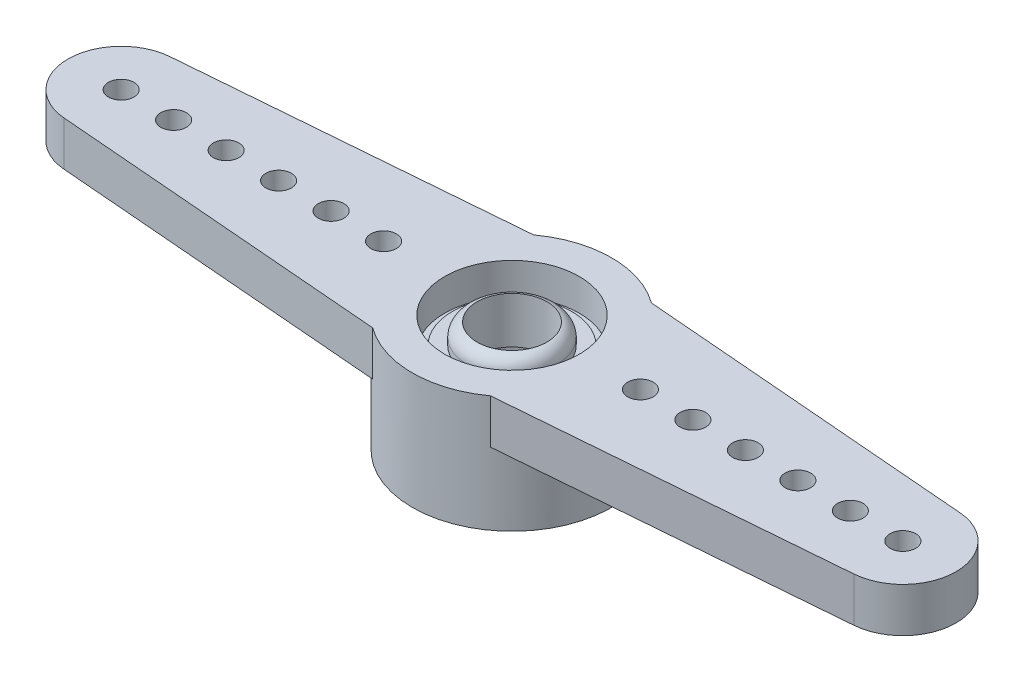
SolidWorks part; units mm, degrees
ref_plane "Front Plane" through (0, 0, 0) normal (0, 0, 1) x (1, 0, 0)
ref_plane "Top Plane" through (0, 0, 0) normal (0, 1, 0) x (1, 0, 0)
ref_plane "Right Plane" through (0, 0, 0) normal (1, 0, 0) x (0, 0, -1)
sketch "Sketch18" plane through (0, 0, 0) normal (0, 1, 0) x (1, 0, 0)
  line L0 (14.1859, 0) -> (-14.1859, 0) construction
  line L1 (-14.3431, 1.924) -> (-2.1374, 2.921)
  line L2 (-14.3431, -1.924) -> (-2.1374, -2.921)
  line L3 (14.3431, -1.924) -> (2.1374, -2.921)
  line L4 (14.3431, 1.924) -> (2.1374, 2.921)
  arc A0 (-2.1374, -2.921) -> (2.1374, -2.921) centre (0, 0) ccw
  arc A1 (-14.3431, 1.924) -> (-14.3431, -1.924) centre (-14.1859, 0) ccw
  arc A2 (14.3431, -1.924) -> (14.3431, 1.924) centre (14.1859, 0) ccw
  arc A3 (2.1374, 2.921) -> (-2.1374, 2.921) centre (0, 0) ccw
  point P3 (0, 0)
  dimension "D1" = 1.9304
  dimension "D2" = 3.6195
  dimension "D3" = 28.3718
  dimension "D5" = 5.842
  dimension "D8" = 1.9304
  dimension "D4" = 2.921
extrude "Extrude17" add sketch "Sketch18" along normal blind 1.6129
sketch "Sketch19" plane through (0, 1.6129, 0) normal (0, 1, 0) x (1, 0, 0)
  circle A0 centre (0, 0) radius 3.6195
  arc A1 (-2.1374, -2.921) -> (2.1374, -2.921) centre (0, 0) ccw construction
extrude "Extrude19" add sketch "Sketch19" against normal blind 4.2291
sketch "Sketch20" plane through (0, 1.6129, 0) normal (0, 1, 0) x (1, 0, 0)
  line L0 (-14.1859, 0) -> (-12.2809, 0) construction
  line L1 (-12.2809, 0) -> (-10.3759, 0) construction
  line L2 (-10.3759, 0) -> (-8.4709, 0) construction
  line L3 (-8.4709, 0) -> (-6.5659, 0) construction
  line L4 (-6.5659, 0) -> (-4.6609, 0) construction
  line L5 (-4.6609, 0) -> (-2.7559, 0) construction
  line L6 (-2.7559, 0) -> (0, 0) construction
  circle A0 centre (-14.1859, 0) radius 0.4636
  circle A1 centre (0, 0) radius 1.27
  circle A3 centre (-4.6609, 0) radius 0.4636
  circle A4 centre (-6.5659, 0) radius 0.4636
  circle A5 centre (-8.4709, 0) radius 0.4636
  circle A6 centre (-10.3759, 0) radius 0.4636
  circle A7 centre (-12.2809, 0) radius 0.4636
  dimension "D1" = 0.9271
  dimension "D3" = 2.54
  dimension "D2" = 1.905
extrude "Extrude20" cut sketch "Sketch20" against normal through all
sketch "Sketch21" plane through (0, 1.6129, 0) normal (0, 1, 0) x (1, 0, 0)
  circle A0 centre (0, 0) radius 2.4447
  dimension "D1" = 4.8895
extrude "Extrude21" cut sketch "Sketch21" against normal blind 1.1557
sketch "Sketch22" plane through (0, -2.6162, 0) normal (0, -1, 0) x (1, 0, 0)
  circle A0 centre (0, 0) radius 2.286
  dimension "D1" = 4.572
extrude "Extrude22" cut sketch "Sketch22" against normal blind 2.3368
sketch "Sketch23" plane through (0, 0.4572, 0) normal (0, 1, 0) x (1, 0, 0)
  circle A0 centre (0, 0) radius 2.159
  dimension "D1" = 4.318
extrude "Extrude23" add sketch "Sketch23" along normal blind 0.2032 separate body
sketch "Sketch24" plane through (0, 0.6604, 0) normal (0, 1, 0) x (1, 0, 0)
  circle A0 centre (0, 0) radius 1.651
  dimension "D1" = 3.302
extrude "Extrude24" add sketch "Sketch24" along normal blind 0.762
sketch "Sketch25" plane through (0, 1.4224, 0) normal (0, 1, 0) x (1, 0, 0)
  line L0 (0, -1.651) -> (0, 1.651) construction
  line L1 (-1.651, 0) -> (1.651, 0) construction
  line L2 (0.254, -1.016) -> (-0.254, -1.016)
  line L3 (-0.254, -1.016) -> (-0.254, -0.254)
  line L4 (-0.254, -0.254) -> (-1.016, -0.254)
  line L5 (-1.016, -0.254) -> (-1.016, 0.254)
  line L6 (0.254, 1.016) -> (-0.254, 1.016)
  line L7 (-0.254, 1.016) -> (-0.254, 0.254)
  line L8 (-0.254, 0.254) -> (-1.016, 0.254)
  line L9 (0.254, 1.016) -> (0.254, 0.254)
  line L10 (0.254, -1.016) -> (0.254, -0.254)
  line L11 (0.254, -0.254) -> (1.016, -0.254)
  line L12 (1.016, -0.254) -> (1.016, 0.254)
  line L13 (0.254, 0.254) -> (1.016, 0.254)
  circle A0 centre (0, 0) radius 1.651 construction
  point P16 (-1.016, 0)
  point P17 (0, 1.016)
  point P19 (0, -1.016)
  dimension "D1" = 2.032
  dimension "D2" = 0.508
extrude "Extrude25" cut sketch "Sketch25" against normal blind 0.508
fillet "Fillet1" radius 0.508 1 edges at (0, 1.4224, 1.651)
mirror "Mirror1" about plane through (0, 0, 0) normal (1, 0, 0) of "Extrude20"
